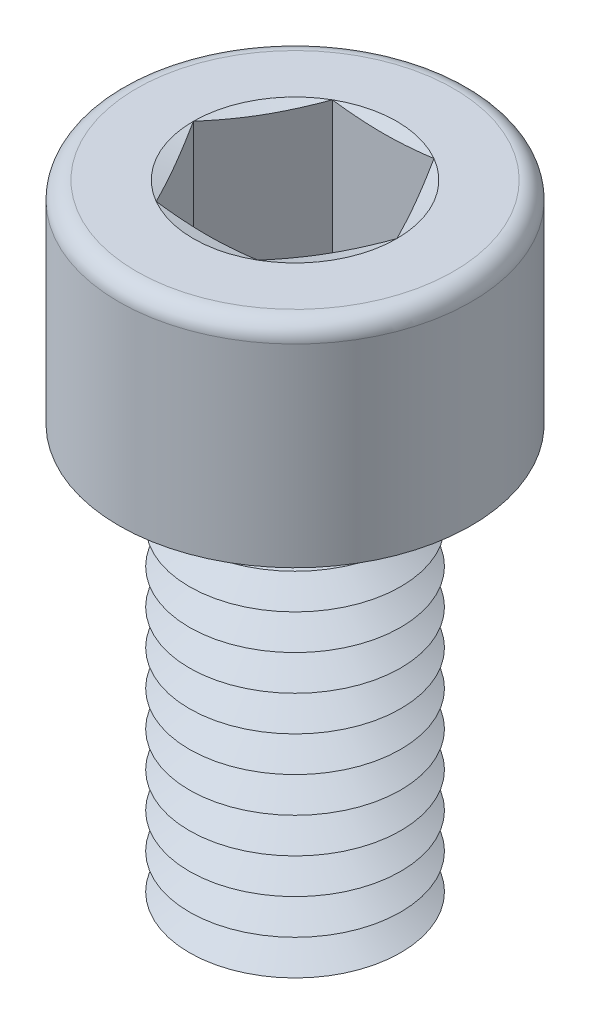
SolidWorks part; units mm, degrees
ref_plane "Front Plane" through (0, 0, 0) normal (0, 0, 1) x (1, 0, 0)
ref_plane "Top Plane" through (0, 0, 0) normal (0, 1, 0) x (1, 0, 0)
ref_plane "Right Plane" through (0, 0, 0) normal (1, 0, 0) x (0, 0, -1)
sketch "Sketch1" plane through (0, 0, 0) normal (0, 1, 0) x (1, 0, 0)
  circle A0 centre (0, 0) radius 3
  dimension "D1" = 6
extrude "Extrude1" add sketch "Sketch1" along normal blind 12
sketch "Sketch2" plane through (0, 12, 0) normal (0, 1, 0) x (1, 0, 0)
  circle A0 centre (0, 0) radius 5
  dimension "D1" = 10
extrude "Extrude2" add sketch "Sketch2" along normal blind 6
sketch "Sketch3" plane through (0, 18, 0) normal (0, 1, 0) x (1, 0, 0)
  line L1 (1.4434, 2.5) -> (-1.4434, 2.5)
  line L2 (-1.4434, 2.5) -> (-2.8868, 0)
  line L3 (-2.8868, 0) -> (-1.4434, -2.5)
  line L4 (-1.4434, -2.5) -> (1.4434, -2.5)
  line L5 (1.4434, -2.5) -> (2.8868, 0)
  line L6 (2.8868, 0) -> (1.4434, 2.5)
  circle A0 centre (0, 0) radius 2.5 construction
  dimension "D1" = 5
extrude "Extrude3" cut sketch "Sketch3" against normal blind 5
fillet "Fillet1" radius 0.5 1 edges at (0, 18, 5)
sketch "Sketch4" plane through (0, 0, 0) normal (1, 0, 0) x (0, 0, -1)
  line L0 (-2.5, 13) -> (0, 13)
  line L1 (0, 13) -> (0, 11.5566)
  line L2 (0, 11.5566) -> (-2.5, 13)
  dimension "D1" = 30
revolve "Cut-Revolve1" cut sketch "Sketch4" angle 360 about L1
sketch "Sketch5" plane through (0, 0, 0) normal (0, 0, 1) x (1, 0, 0)
  line L0 (-3, 0.5) -> (-3, -0.5)
  line L1 (-3, 12) -> (-3, 0) construction
  line L2 (-3, -0.5) -> (-2.134, 0)
  line L3 (-3, 0) -> (3, 0) construction
  line L4 (-2.134, 0) -> (-3, 0.5)
  dimension "D1" = 1
revolve "Cut-Revolve2" cut sketch "Sketch5" angle 360 about axis through (0, 12, 0) along (0, -1, 0)
pattern_linear "LPattern1" count 12 spacing 1 along (0, 1, 0) of "Cut-Revolve2"
sketch "Sketch6" plane through (0, 18, 0) normal (0, 1, 0) x (1, 0, 0)
  circle A0 centre (0, 0) radius 2.8868
extrude "Extrude4" cut sketch "Sketch6" against normal through all draft 75
